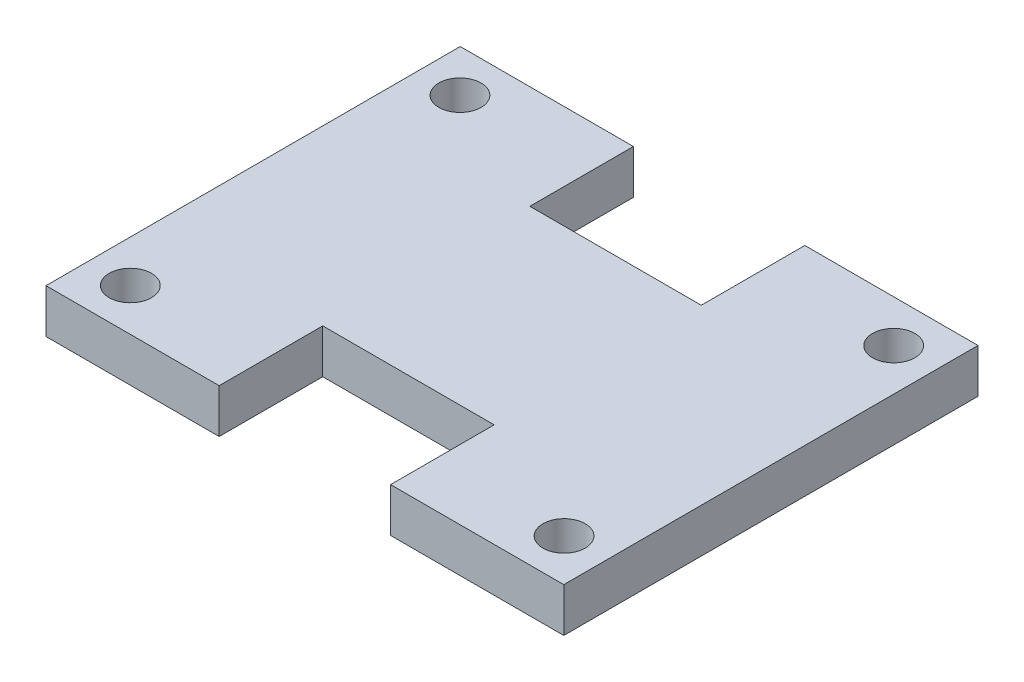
SolidWorks part; units mm, degrees
ref_plane "Front Plane" through (0, 0, 0) normal (0, 0, 1) x (1, 0, 0)
ref_plane "Top Plane" through (0, 0, 0) normal (0, 1, 0) x (1, 0, 0)
ref_plane "Right Plane" through (0, 0, 0) normal (1, 0, 0) x (0, 0, -1)
sketch "Sketch1" plane through (0, 0, 0) normal (0, 1, 0) x (1, 0, 0)
  line L0 (-14.9225, 0) -> (14.9225, 0) construction
  line L1 (-14.9225, 11.938) -> (-4.9403, 11.938)
  line L2 (-14.9225, 11.938) -> (-14.9225, -11.938)
  line L3 (-14.9225, -11.938) -> (-4.9403, -11.938)
  line L4 (14.9225, 11.938) -> (14.9225, -11.938)
  line L5 (-14.9225, 11.938) -> (14.9225, -11.938) construction
  line L6 (-14.9225, -11.938) -> (14.9225, 11.938) construction
  line L8 (-4.9403, 11.938) -> (-4.9403, 5.969)
  line L9 (-4.9403, 5.969) -> (4.9403, 5.969)
  line L10 (4.9403, 11.938) -> (4.9403, 5.969)
  line L11 (4.9403, -11.938) -> (4.9403, -5.969)
  line L12 (-4.9403, -5.969) -> (4.9403, -5.969)
  line L13 (-4.9403, -11.938) -> (-4.9403, -5.969)
  line L14 (4.9403, 11.938) -> (14.9225, 11.938)
  line L15 (4.9403, -11.938) -> (14.9225, -11.938)
  point P0 (0, 0)
  dimension "D1" = 29.845
  dimension "D2" = 23.876
  dimension "D3" = 9.9822
  dimension "D4" = 9.9822
  dimension "D5" = 5.969
extrude "Boss-Extrude1" add sketch "Sketch1" along normal blind 2.54
hole_wizard "#2 Clearance Hole1" positions "Sketch2" profile "Sketch3" hole size "#2" standard "ANSI Inch"
sketch "Sketch2" plane through (0, 2.54, 0) normal (0, 1, 0) x (1, 0, 0)
  line L0 (-12.5, 9.4996) -> (12.5, 9.4996) construction
  line L1 (12.5, 9.4996) -> (12.5, -9.4996) construction
  line L2 (12.5, -9.4996) -> (-12.5, -9.4996) construction
  line L3 (-12.5, -9.4996) -> (-12.5, 9.4996) construction
  line L5 (0, 5.969) -> (0, -5.969) construction
  line L6 (4.9403, 5.969) -> (-4.9403, 5.969) construction
  line L7 (-4.9403, -5.969) -> (4.9403, -5.969) construction
  line L9 (-14.9225, 0) -> (14.9225, 0) construction
  line L10 (-14.9225, 11.938) -> (-14.9225, -11.938) construction
  line L11 (14.9225, -11.938) -> (14.9225, 11.938) construction
  point P0 (-12.5, 9.4996)
  point P2 (12.5, 9.4996)
  point P4 (12.5, -9.4996)
  point P6 (-12.5, -9.4996)
  dimension "D1" = 12.5
  dimension "D2" = 12.5
  dimension "D3" = 9.4996
  dimension "D4" = 9.4996
sketch "Sketch3" plane through (-12.5, 2.54, -9.4996) normal (1, 0, 0) x (0, 0, 1)
  line L0 (0, 0) -> (0, 2.54)
  line L1 (0, 2.54) -> (1.2192, 2.54)
  line L2 (1.2192, 2.54) -> (1.2192, 0)
  line L5 (1.2192, 0) -> (0, 0)
  line L11 (0, -6.35) -> (0, 107.95) construction
  dimension "Thru Hole Dia." = 2.4384
  dimension "Thru Hole Depth" = 2.54
